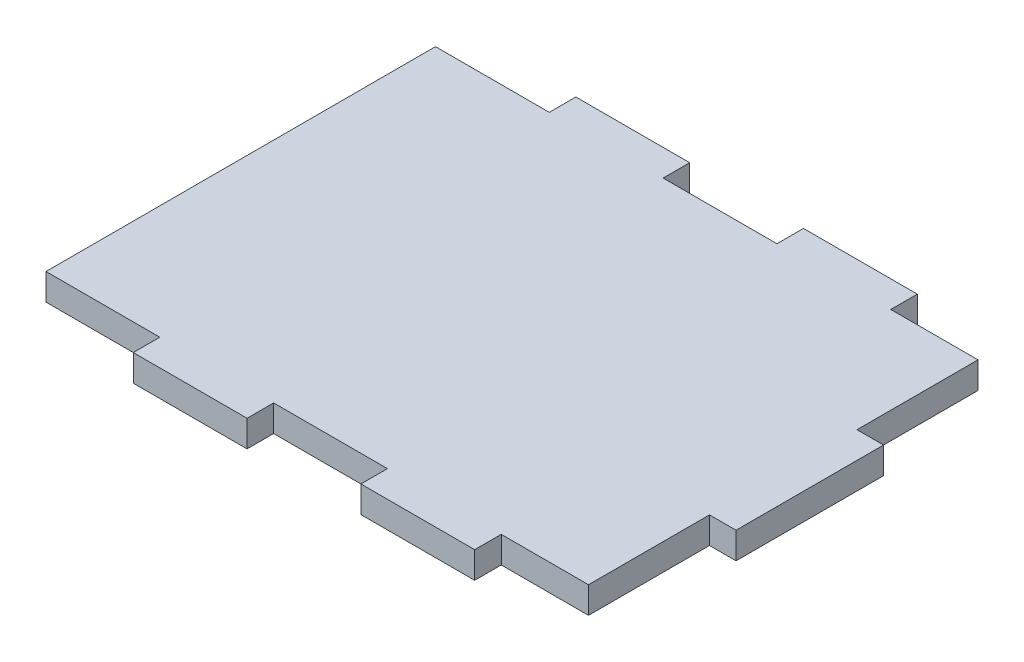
SolidWorks part; units mm, degrees
ref_plane "Front Plane" through (0, 0, 0) normal (0, 0, 1) x (1, 0, 0)
ref_plane "Top Plane" through (0, 0, 0) normal (0, 1, 0) x (1, 0, 0)
ref_plane "Right Plane" through (0, 0, 0) normal (1, 0, 0) x (0, 0, -1)
sketch "Sketch1" plane through (0, 0, 0) normal (0, 1, 0) x (1, 0, 0)
  line L1 (-57.15, -44.45) -> (57.15, -44.45)
  line L2 (-57.15, -44.45) -> (-57.15, 44.45)
  line L3 (-57.15, 44.45) -> (57.15, 44.45)
  line L4 (57.15, -44.45) -> (57.15, 44.45)
  line L5 (-57.15, -44.45) -> (57.15, 44.45) construction
  line L6 (-57.15, 44.45) -> (57.15, -44.45) construction
  point P0 (0, 0)
  dimension "D1" = 114.3
  dimension "D2" = 88.9
extrude "Boss-Extrude1" add sketch "Sketch1" along normal blind 5.334
other "Cavity2"
other "boxSide<2>@MinSpecRobot1"
other "boxBack<1>@MinSpecRobot1"
other "boxSide<1>@MinSpecRobot1"
equation "\"D1@Boss-Extrude1\" = \"material\""
equation "\"material\"= \"MDF@Platform.assembly\""
